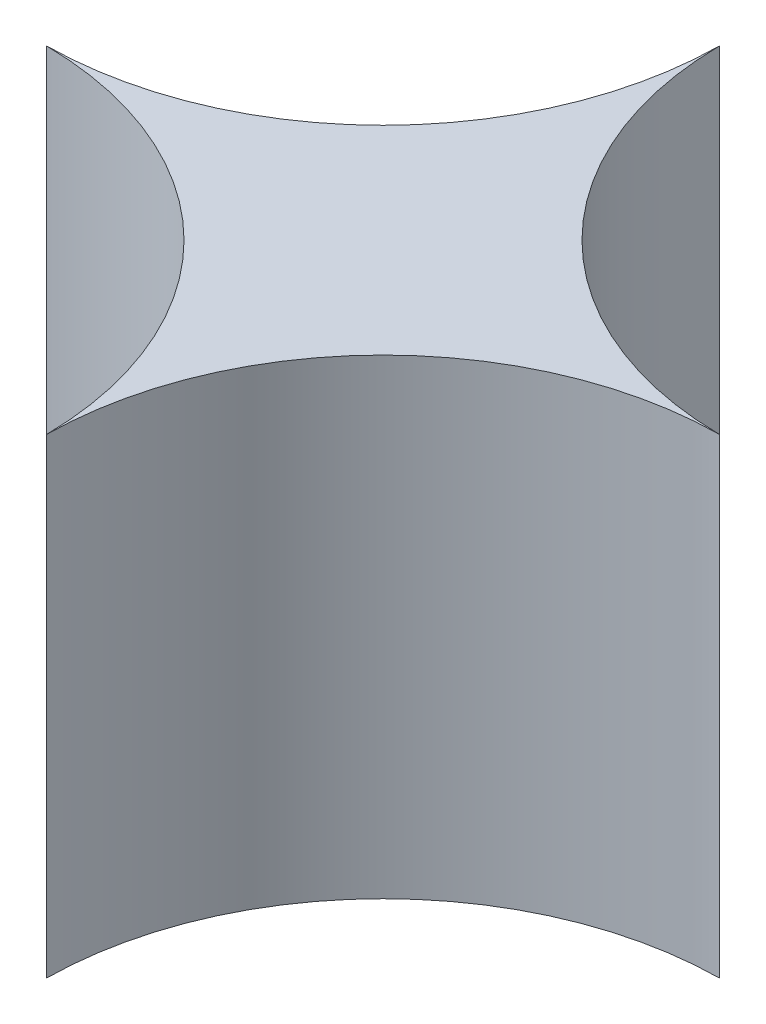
SolidWorks part; units mm, degrees
ref_plane "Front Plane" through (0, 0, 0) normal (0, 0, 1) x (1, 0, 0)
ref_plane "Top Plane" through (0, 0, 0) normal (0, 1, 0) x (1, 0, 0)
ref_plane "Right Plane" through (0, 0, 0) normal (1, 0, 0) x (0, 0, -1)
sketch "Sketch1" plane through (0, 0, 0) normal (0, 1, 0) x (1, 0, 0)
  line L1 (-25, -25) -> (25, -25)
  line L2 (-25, -25) -> (-25, 25)
  line L3 (-25, 25) -> (25, 25)
  line L4 (25, -25) -> (25, 25)
  line L5 (-25, -25) -> (25, 25) construction
  line L6 (-25, 25) -> (25, -25) construction
  line L7 (-25.25, -25.25) -> (25.25, -25.25) construction
  line L8 (-25.25, -25.25) -> (-25.25, 25.25) construction
  line L9 (-25.25, 25.25) -> (25.25, 25.25) construction
  line L10 (25.25, -25.25) -> (25.25, 25.25) construction
  line L11 (-25.25, -25.25) -> (25.25, 25.25) construction
  line L12 (-25.25, 25.25) -> (25.25, -25.25) construction
  circle A1 centre (-25.25, 25.25) radius 25.25
  circle A4 centre (25.25, 25.25) radius 25.25
  circle A5 centre (25.25, -25.25) radius 25.25
  circle A6 centre (-25.25, -25.25) radius 25.25
  point P0 (0, 0)
  point P6 (0, 0)
  dimension "D5" = 50.5
  dimension "D6" = 50.5
  dimension "D7" = 50.5
  dimension "D8" = 50.5
  dimension "D1" = 50
  dimension "D2" = 50
  dimension "D3" = 50.5
  dimension "D4" = 50.5
extrude "Boss-Extrude1" add sketch "Sketch1" along normal blind 35 contours A6 L4 A5 L3 A1 L2 A4 L1
scale "Scale1" scale about centroid uniform scaling yes scale factor 0.9
